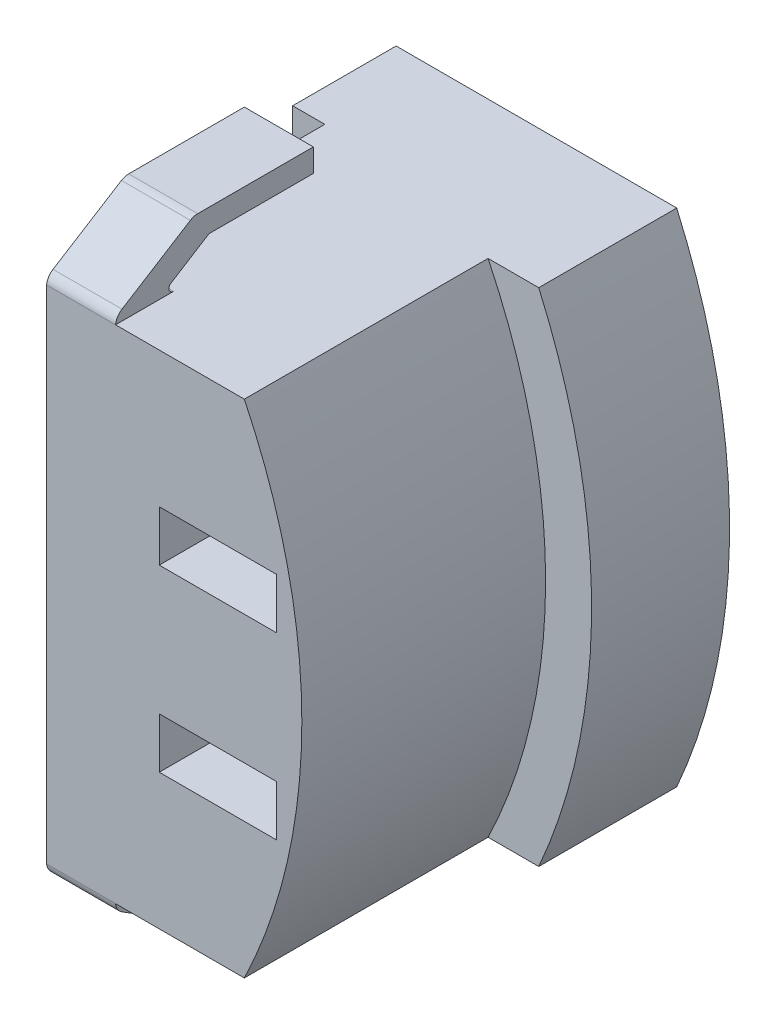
SolidWorks part; units mm, degrees
ref_plane "Plan de face" through (0, 0, 0) normal (0, 0, 1) x (1, 0, 0)
ref_plane "Plan de dessus" through (0, 0, 0) normal (0, 1, 0) x (1, 0, 0)
ref_plane "Plan de droite" through (0, 0, 0) normal (1, 0, 0) x (0, 0, -1)
sketch "Esquisse1" plane through (0, 0, 0) normal (0, 0, 1) x (1, 0, 0)
  line L0 (6.95, 5.45) -> (6.95, -5.45)
  line L1 (6.95, 5.45) -> (11.2493, 5.45)
  line L3 (9.4, 2.5) -> (11.95, 2.5)
  line L4 (6.95, -5.45) -> (11.2493, -5.45)
  line L5 (9.4, 2.5) -> (9.4, 1.4)
  line L6 (9.4, 1.4) -> (11.95, 1.4)
  line L7 (11.95, 2.5) -> (11.95, 1.4)
  line L8 (9.4, -1.4) -> (11.95, -1.4)
  line L9 (9.4, -1.4) -> (9.4, -2.5)
  line L10 (9.4, -2.5) -> (11.95, -2.5)
  line L11 (11.95, -1.4) -> (11.95, -2.5)
  arc A1 (11.2493, -5.45) -> (11.2493, 5.45) centre (0, 0) ccw
  dimension "D3" = 12.5
  dimension "D1" = 6.95
  dimension "D2" = 5.45
  dimension "D4" = 10.9
  dimension "D5" = 1.1
  dimension "D6" = 1.1
  dimension "D7" = 2.55
  dimension "D8" = 2.55
  dimension "D9" = 2.45
  dimension "D10" = 2.45
  dimension "D11" = 1.4
  dimension "D12" = 1.4
extrude "Extrusion1" add sketch "Esquisse1" along normal blind 5.3
sketch "Esquisse2" plane through (0, 0, 0) normal (0, 0, -1) x (-1, 0, 0)
  line L0 (-6.95, 5.45) -> (-12.351, 5.45)
  line L1 (-6.95, -5.45) -> (-12.351, -5.45)
  line L2 (-6.95, 5.45) -> (-6.95, -5.45) construction
  line L3 (-6.95, -5.45) -> (-11.2493, -5.45) construction
  line L4 (-6.95, -5.45) -> (-6.95, 5.45)
  arc A0 (-12.351, 5.45) -> (-12.351, -5.45) centre (0, 0) ccw
  dimension "D1" = 13.5
extrude "Extrusion2" add sketch "Esquisse2" along normal blind 3
sketch "Esquisse3" plane through (0, 0, -3) normal (0, 0, -1) x (-1, 0, 0)
  line L0 (-11.8913, 4.6) -> (-6.95, 4.6)
  line L1 (-6.95, -5.45) -> (-6.95, 5.45) construction
  line L2 (-11.8913, -4.6) -> (-6.95, -4.6)
  line L3 (-6.95, 5.45) -> (-12.351, 5.45) construction
  line L4 (-12.351, -5.45) -> (-6.95, -5.45) construction
  line L5 (-6.95, 4.6) -> (-6.95, -4.6)
  arc A0 (-11.8913, 4.6) -> (-11.8913, -4.6) centre (0, 0) ccw
  point P9 (-9.6505, 5.45)
  dimension "D3" = 12.75
  dimension "D1" = 0.85
  dimension "D2" = 0.85
extrude "Enlèv. mat.-Extru.1" cut sketch "Esquisse3" against normal blind 1.95
sketch "Esquisse4" plane through (0, 0, -1.05) normal (0, 0, -1) x (-1, 0, 0)
  line L0 (-6.95, -4.6) -> (-6.95, 4.6) construction
  line L1 (-7.7, 4.55) -> (-8.45, 4.55)
  line L2 (-7.7, 4.55) -> (-7.7, 1.95)
  line L3 (-7.7, 1.95) -> (-8.45, 1.95)
  line L4 (-8.45, 4.55) -> (-8.45, 1.95)
  line L5 (-7.7, 1.3) -> (-8.45, 1.3)
  line L6 (-7.7, 1.3) -> (-7.7, -1.3)
  line L7 (-7.7, -1.3) -> (-8.45, -1.3)
  line L8 (-8.45, 1.3) -> (-8.45, -1.3)
  line L9 (-7.7, -1.95) -> (-8.45, -1.95)
  line L10 (-7.7, -1.95) -> (-7.7, -4.55)
  line L11 (-7.7, -4.55) -> (-8.45, -4.55)
  line L12 (-8.45, -1.95) -> (-8.45, -4.55)
  line L14 (-11.1, 4.55) -> (-9.35, 4.55)
  line L15 (-11.1, 4.55) -> (-11.1, 3.45)
  line L16 (-11.1, 3.45) -> (-9.35, 3.45)
  line L17 (-9.35, 4.55) -> (-9.35, 3.45)
  line L18 (-11.1, 0.55) -> (-9.35, 0.55)
  line L19 (-11.1, 0.55) -> (-11.1, -0.55)
  line L20 (-11.1, -0.55) -> (-9.35, -0.55)
  line L21 (-9.35, 0.55) -> (-9.35, -0.55)
  line L22 (-11.1, -4.55) -> (-9.35, -4.55)
  line L23 (-11.1, -4.55) -> (-11.1, -3.45)
  line L24 (-11.1, -3.45) -> (-9.35, -3.45)
  line L25 (-9.35, -4.55) -> (-9.35, -3.45)
  dimension "D1" = 2.6
  dimension "D2" = 1.3
  dimension "D3" = 0.65
  dimension "D4" = 2.6
  dimension "D5" = 0.65
  dimension "D6" = 2.6
  dimension "D7" = 0.75
  dimension "D8" = 0.75
  dimension "D9" = 0.75
  dimension "D10" = 0.75
  dimension "D11" = 0.75
  dimension "D12" = 0.75
  dimension "D13" = 1.75
  dimension "D14" = 1.75
  dimension "D15" = 1.75
  dimension "D16" = 0.9
  dimension "D17" = 0.9
  dimension "D18" = 0.9
  dimension "D19" = 1.1
  dimension "D20" = 1.1
  dimension "D21" = 1.1
  dimension "D22" = 0.55
  dimension "D23" = 1.1
  dimension "D24" = 1.1
extrude "Enlèv. mat.-Extru.2" cut sketch "Esquisse4" against normal blind 5
sketch "Esquisse5" plane through (0, 0, -1.05) normal (0, 0, -1) x (-1, 0, 0)
  line L1 (-8.45, 1.95) -> (-10.25, 1.95)
  line L2 (-8.45, 1.95) -> (-8.45, 1.35)
  line L3 (-8.45, 1.35) -> (-11.05, 1.35)
  line L4 (-11.05, 1.95) -> (-11.05, 1.35)
  line L5 (-8.45, -1.3) -> (-11.05, -1.3)
  line L6 (-8.45, -1.3) -> (-8.45, -1.9)
  line L7 (-8.45, -1.9) -> (-10.25, -1.9)
  line L8 (-11.05, -1.3) -> (-11.05, -1.9)
  line L9 (-11.05, 1.95) -> (-11.85, 1.95)
  line L10 (-10.25, 1.95) -> (-10.25, 2.55)
  line L11 (-10.25, 2.55) -> (-11.85, 2.55)
  line L12 (-11.85, 1.95) -> (-11.85, 2.55)
  line L13 (-11.05, -1.9) -> (-11.85, -1.9)
  line L14 (-10.25, -1.9) -> (-10.25, -2.5)
  line L15 (-10.25, -2.5) -> (-11.85, -2.5)
  line L16 (-11.85, -1.9) -> (-11.85, -2.5)
  dimension "D1" = 0.6
  dimension "D2" = 0.6
  dimension "D3" = 2.6
  dimension "D4" = 2.6
  dimension "D5" = 0.6
  dimension "D6" = 0.6
  dimension "D7" = 0.8
  dimension "D8" = 0.8
  dimension "D9" = 0.8
  dimension "D10" = 0.8
  dimension "D11" = 1.2
  dimension "D12" = 1.2
extrude "Extrusion3" add sketch "Esquisse5" along normal blind 1.5
sketch "Esquisse6" plane through (0, 0, -3) normal (0, 0, -1) x (-1, 0, 0)
  line L0 (-6.95, 5.45) -> (-12.351, 5.45) construction
  line L1 (-11.9, 4.3043) -> (-6.45, 4.3043)
  line L2 (-11.9, 4.3043) -> (-11.9, 4.95)
  line L3 (-11.9, 4.95) -> (-6.45, 4.95)
  line L4 (-6.45, 4.3043) -> (-6.45, 4.95)
  line L5 (-6.45, -4.3043) -> (-6.45, -4.95)
  line L6 (-11.9, -4.95) -> (-6.45, -4.95)
  line L7 (-11.9, -4.3043) -> (-11.9, -4.95)
  line L8 (-11.9, -4.3043) -> (-6.45, -4.3043)
  line L10 (-6.95, 4.6) -> (-6.95, 5.45) construction
  line L11 (-6.95, 0) -> (-4.8547, 0) construction
  line L12 (-6.95, -4.6) -> (-6.95, 4.6) construction
  dimension "D1" = 0.5
  dimension "D3" = 0.5
  dimension "D4" = 5.45
  dimension "D5" = 0.6457
extrude "Enlèv. mat.-Extru.3" cut sketch "Esquisse6" against normal up to surface (0.45 mm away)
sketch "Esquisse7" plane through (6.95, 0, 0) normal (-1, 0, 0) x (0, 0, 1)
  line L1 (5.1604, -5.6749) -> (3.673, -6.6044)
  line L2 (3.514, -6.65) -> (1, -6.65)
  line L3 (1, -6.65) -> (1, -6.15)
  line L4 (1, -6.15) -> (3.2679, -6.15)
  line L5 (3.2679, -6.15) -> (4.3882, -5.45)
  line L6 (5.3, -5.45) -> (-3, -5.45) construction
  line L7 (4.3882, -5.45) -> (5.3, -5.45)
  line L8 (5.3, 5.45) -> (5.3, -5.45) construction
  arc A0 (5.3, -5.45) -> (5.1604, -5.6749) centre (5.0015, -5.4205) cw
  arc A1 (3.673, -6.6044) -> (3.514, -6.65) centre (3.514, -6.35) cw
  point P16 (3.6, -6.65)
  dimension "D6" = 0.3
  dimension "D1" = 1.2
  dimension "D2" = 0.5
  dimension "D3" = 0.6
  dimension "D4" = 4.3
  dimension "D5" = 2.6
  dimension "D7" = 32
extrude "Extrusion4" add sketch "Esquisse7" against normal blind 1.5
mirror "Symétrie2" about plane through (0, 0, 0) normal (0, 1, 0) of "Extrusion4"
fillet "Congé1" radius 0.1 2 edges
sketch "Esquisse8" plane through (0, 0, -1.05) normal (0, 0, -1) x (-1, 0, 0)
  line L1 (-6.95, 5.45) -> (-6.25, 5.45)
  line L2 (-6.95, 5.45) -> (-6.95, -5.45)
  line L3 (-6.95, -5.45) -> (-6.25, -5.45)
  line L4 (-6.25, 5.45) -> (-6.25, -5.45)
  dimension "D1" = 0.7
  dimension "D2" = 10.9
extrude "Extrusion6" add sketch "Esquisse8" along normal up to surface (1.95 mm away) and the other way blind 0.3
sketch "Esquisse9" plane through (0, 0, -2.55) normal (0, 0, -1) x (-1, 0, 0)
  line L0 (-6.25, -5.45) -> (-6.25, 5.45) construction
  line L1 (-7.25, 2.5) -> (-5.05, 2.5)
  line L2 (-7.25, 2.5) -> (-7.25, -2.5)
  line L3 (-7.25, -2.5) -> (-5.05, -2.5)
  line L4 (-5.05, 2.5) -> (-5.05, -2.5)
  dimension "D1" = 2.5
  dimension "D2" = 5
  dimension "D3" = 1
  dimension "D4" = 2.2
extrude "Enlèv. mat.-Extru.4" cut sketch "Esquisse9" along normal blind 1.5
